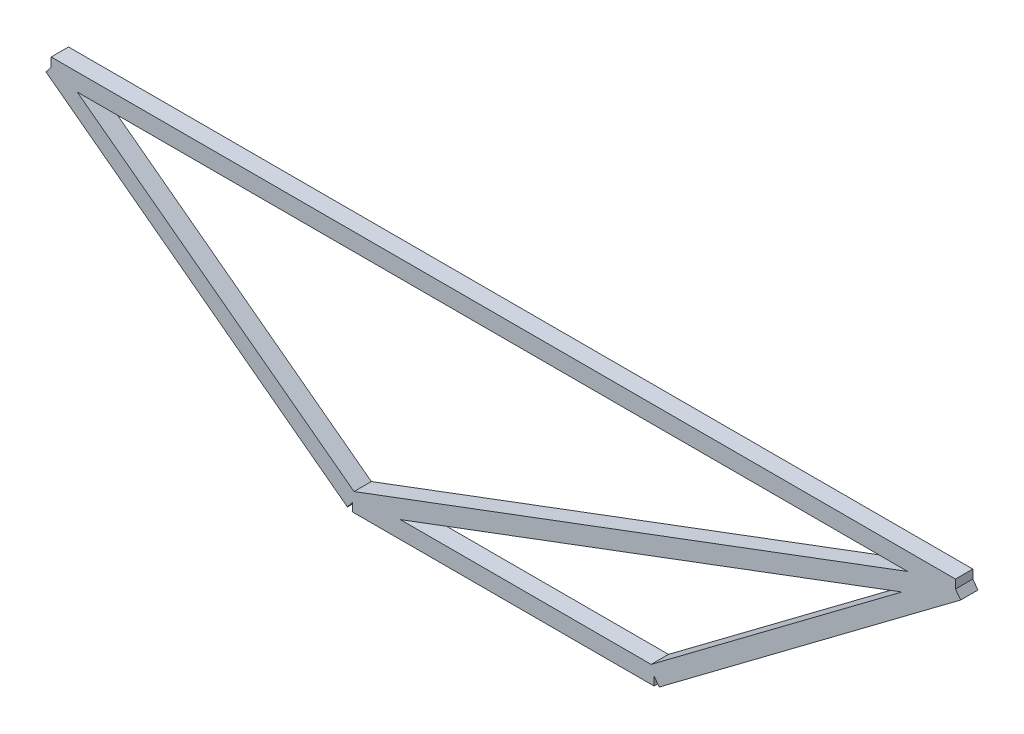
SolidWorks part; units mm, degrees
ref_plane "Front Plane" through (0, 0, 0) normal (0, 0, 1) x (1, 0, 0)
ref_plane "Top Plane" through (0, 0, 0) normal (0, 1, 0) x (1, 0, 0)
ref_plane "Right Plane" through (0, 0, 0) normal (1, 0, 0) x (0, 0, -1)
sketch "Sketch1" plane through (0, 0, 0) normal (0, 0, 1) x (1, 0, 0)
  line L0 (0, 11.5) -> (1200, 11.5)
  line L1 (1200, 11.5) -> (1200, -11.5)
  line L2 (1200, -11.5) -> (0, -11.5)
  line L3 (0, -11.5) -> (0, 11.5)
extrude "Boss-Extrude1" add sketch "Sketch1" along normal blind 23
sketch "Sketch2" plane through (0, 0, 0) normal (0, 0, 1) x (1, 0, 0)
  line L0 (6.9, 9.2) -> (406.9, -290.8)
  line L1 (406.9, -290.8) -> (393.1, -309.2)
  line L2 (393.1, -309.2) -> (-6.9, -9.2)
  line L3 (-6.9, -9.2) -> (6.9, 9.2)
extrude "Boss-Extrude2" add sketch "Sketch2" along normal blind 23
sketch "Sketch3" plane through (0, 0, 0) normal (0, 0, 1) x (1, 0, 0)
  line L0 (400, -288.5) -> (800, -288.5)
  line L1 (800, -288.5) -> (800, -311.5)
  line L2 (800, -311.5) -> (400, -311.5)
  line L3 (400, -311.5) -> (400, -288.5)
extrude "Boss-Extrude3" add sketch "Sketch3" along normal blind 23
sketch "Sketch4" plane through (0, 0, 0) normal (0, 0, 1) x (1, 0, 0)
  line L0 (793.1, -290.8) -> (1193.1, 9.2)
  line L1 (1193.1, 9.2) -> (1206.9, -9.2)
  line L2 (1206.9, -9.2) -> (806.9, -309.2)
  line L3 (806.9, -309.2) -> (793.1, -290.8)
extrude "Boss-Extrude4" add sketch "Sketch4" along normal blind 23
sketch "Sketch5" plane through (0, 0, 0) normal (0, 0, 1) x (1, 0, 0)
  line L0 (1204.0379, -10.7678) -> (404.0379, -310.7678)
  line L1 (404.0379, -310.7678) -> (395.9621, -289.2322)
  line L2 (395.9621, -289.2322) -> (1195.9621, 10.7678)
  line L3 (1195.9621, 10.7678) -> (1204.0379, -10.7678)
extrude "Boss-Extrude5" add sketch "Sketch5" along normal blind 23
